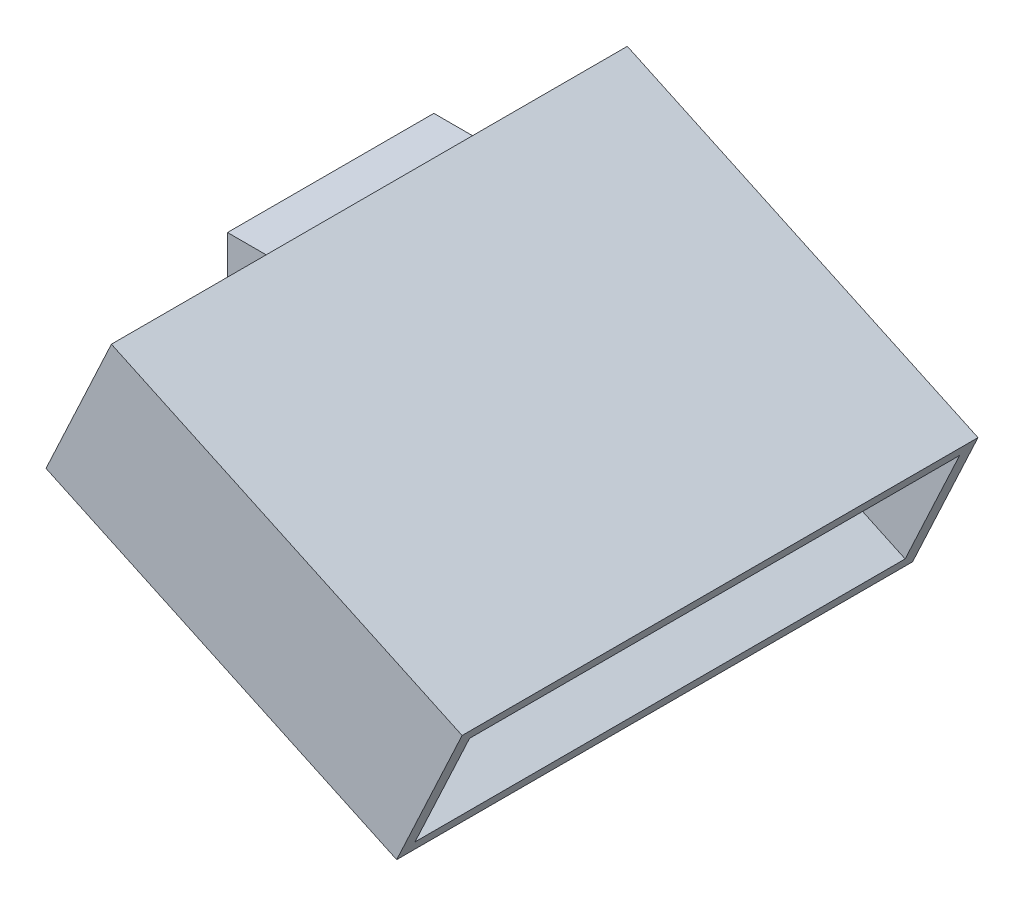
SolidWorks part; units mm, degrees
ref_plane "前视基准面" through (0, 0, 0) normal (0, 0, 1) x (1, 0, 0)
ref_plane "上视基准面" through (0, 0, 0) normal (0, 1, 0) x (1, 0, 0)
ref_plane "右视基准面" through (0, 0, 0) normal (1, 0, 0) x (0, 0, -1)
sketch "草图1" plane through (0, 0, 0) normal (1, 0, 0) x (0, 0, -1)
  line L1 (-35, -9.81) -> (35, -9.81)
  line L2 (-35, -9.81) -> (-35, 9.81)
  line L3 (-35, 9.81) -> (35, 9.81)
  line L4 (35, -9.81) -> (35, 9.81)
  line L5 (-35, -9.81) -> (35, 9.81) construction
  line L6 (-35, 9.81) -> (35, -9.81) construction
  line L7 (-40, -14.81) -> (40, -14.81)
  line L8 (-40, -14.81) -> (-40, 14.81)
  line L9 (-40, 14.81) -> (40, 14.81)
  line L10 (40, -14.81) -> (40, 14.81)
  line L11 (-40, -14.81) -> (40, 14.81) construction
  line L12 (-40, 14.81) -> (40, -14.81) construction
  point P0 (0, 0)
  point P6 (0, 0)
  dimension "D1" = 29.62
  dimension "D2" = 80
  dimension "D3" = 5
  dimension "D4" = 5
extrude "凸台-拉伸1" add sketch "草图1" along normal blind 15
ref_plane "基准面1" through (8.3517, 17.9102, 0) normal (-0.4226, -0.9063, 0) x (0, 0, 1)
sketch "草图6" plane through (8.3517, 17.9102, 0) normal (-0.4226, -0.9063, 0) x (0, 0, 1)
  line L0 (-40, -7.3356) -> (40, -7.3356) construction
  line L1 (100, -7.3356) -> (-100, -7.3356)
  line L2 (100, -7.3356) -> (100, -157.3356)
  line L3 (100, -157.3356) -> (-100, -157.3356)
  line L4 (-100, -7.3356) -> (-100, -157.3356)
  line L5 (40, -7.3356) -> (40, 6.259) construction
  dimension "D1" = 200
  dimension "D2" = 150
  dimension "D3" = 0
  dimension "D4" = 60
extrude "凸台-拉伸4" add sketch "草图6" along normal blind 60
sketch "草图8" plane through (142.5945, -66.4929, 0) normal (0.9063, -0.4226, 0) x (0, 0, -1)
  line L0 (-100, -40.2383) -> (-100, 19.7617) construction
  line L1 (-95, 14.7617) -> (95, 14.7617)
  line L2 (-95, 14.7617) -> (-95, -35.2383)
  line L3 (-95, -35.2383) -> (95, -35.2383)
  line L4 (95, 14.7617) -> (95, -35.2383)
  line L5 (100, -40.2383) -> (100, 19.7617) construction
  line L6 (100, 19.7617) -> (-100, 19.7617) construction
  line L7 (100, -40.2383) -> (-100, -40.2383) construction
  dimension "D1" = 5
  dimension "D2" = 5
  dimension "D3" = 5
  dimension "D4" = 5
extrude "切除-拉伸6" cut sketch "草图8" against normal blind 145
sketch "草图9" plane through (6.6483, -3.1002, 0) normal (-0.9063, 0.4226, 0) x (0, 0, 1)
  line L1 (-35, 14.2448) -> (35, 14.2448)
  line L2 (-35, 14.2448) -> (-35, -7.4035)
  line L3 (-35, -7.4035) -> (35, -7.4035)
  line L4 (35, 14.2448) -> (35, -7.4035)
extrude "切除-拉伸7" cut sketch "草图9" against normal up to next
